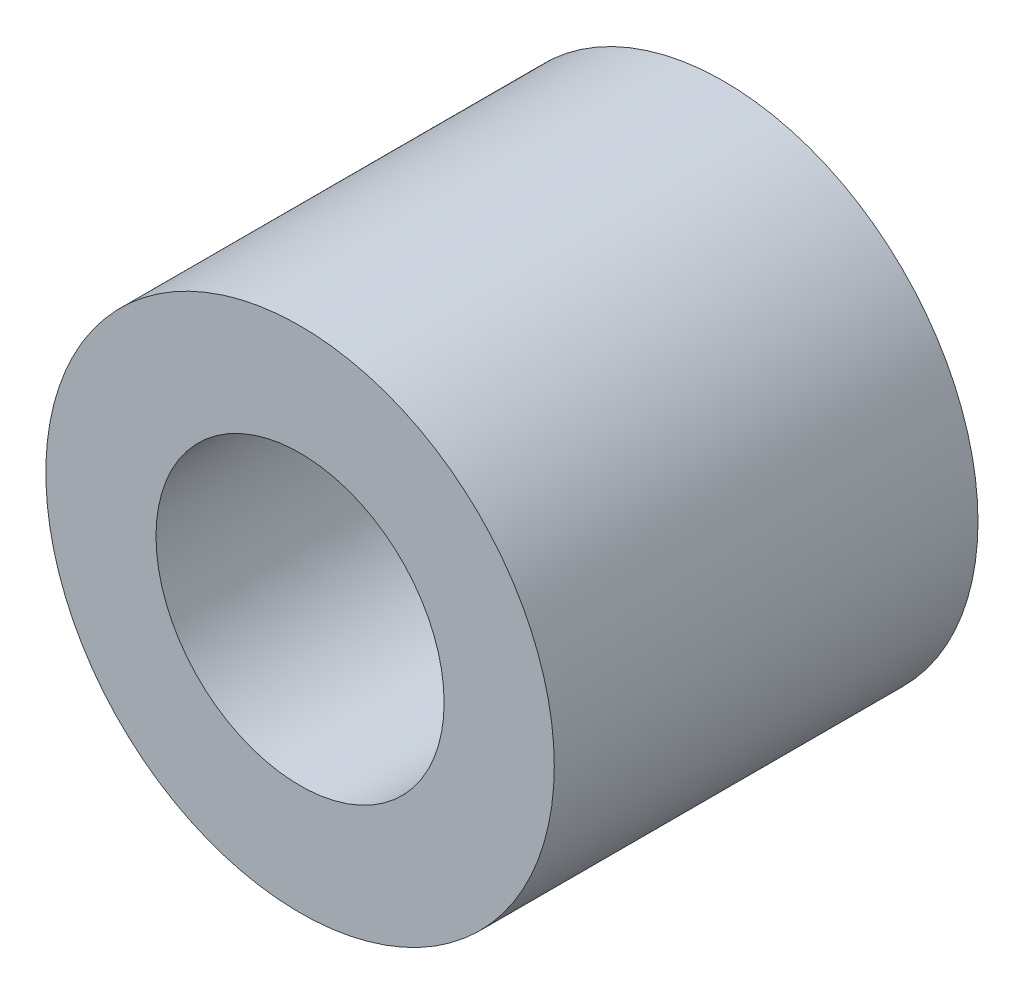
SolidWorks part; units mm, degrees
ref_plane "前视基准面" through (0, 0, 0) normal (0, 0, 1) x (1, 0, 0)
ref_plane "上视基准面" through (0, 0, 0) normal (0, 1, 0) x (1, 0, 0)
ref_plane "右视基准面" through (0, 0, 0) normal (1, 0, 0) x (0, 0, -1)
other "Configuration Table"
sketch "草图1" plane through (0, 0, 0) normal (0, 0, 1) x (1, 0, 0)
  circle A0 centre (0, 0) radius 3
  circle A1 centre (0, 0) radius 1.7
  dimension "D1" = 3.4
  dimension "D2" = 6
extrude "M3_clearance_sleeve_5mm" add sketch "草图1" along normal blind 5
